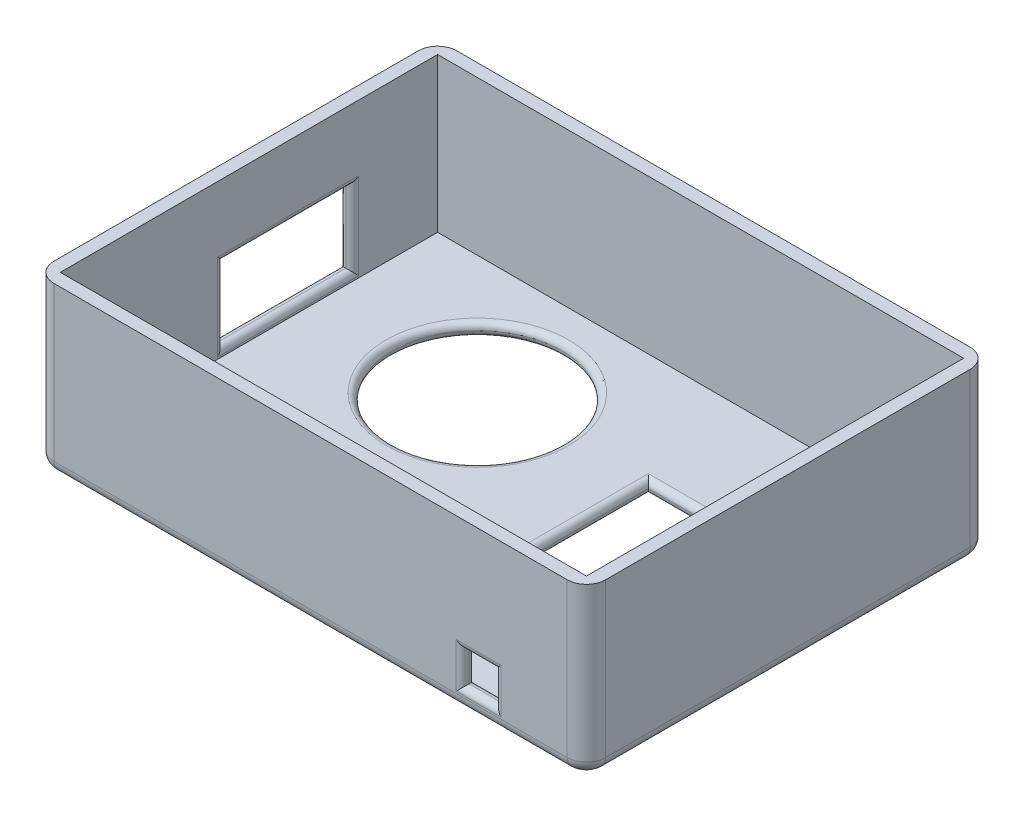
SolidWorks part; units mm, degrees
ref_plane "Front Plane" through (0, 0, 0) normal (0, 0, 1) x (1, 0, 0)
ref_plane "Top Plane" through (0, 0, 0) normal (0, 1, 0) x (1, 0, 0)
ref_plane "Right Plane" through (0, 0, 0) normal (1, 0, 0) x (0, 0, -1)
sketch "Sketch1" plane through (0, 0, 0) normal (0, 1, 0) x (1, 0, 0)
  line L1 (33.232, -29) -> (-48.768, -29)
  line L2 (33.232, -29) -> (33.232, 29.798)
  line L3 (33.232, 29.798) -> (-48.768, 29.798)
  line L4 (-48.768, -29) -> (-48.768, 29.798)
  line L5 (-50.768, -31) -> (35.232, -31)
  line L6 (-50.768, -31) -> (-50.768, 31.798)
  line L7 (-50.768, 31.798) -> (35.232, 31.798)
  line L8 (35.232, -31) -> (35.232, 31.798)
  line L9 (1.232, 12.648) -> (18.732, 12.648)
  line L10 (1.232, 12.648) -> (1.232, -23)
  line L11 (1.232, -23) -> (18.732, -23)
  line L12 (18.732, 12.648) -> (18.732, -23)
  line L13 (-50.768, 31.798) -> (35.232, 31.798)
  line L14 (-50.768, 31.798) -> (-50.768, -31)
  line L15 (-50.768, -31) -> (35.232, -31)
  line L16 (35.232, 31.798) -> (35.232, -31)
  line L17 (-48.768, 29.798) -> (33.232, 29.798)
  line L18 (-48.768, 29.798) -> (-48.768, -29)
  line L19 (-48.768, -29) -> (33.232, -29)
  line L20 (33.232, 29.798) -> (33.232, -29)
  circle A1 centre (-24.017, 11.249) radius 13.249
  point P0 (0, 0)
  point P6 (0, 0)
  point P11 (9.882, 11.072)
  point P18 (9.982, 12.648)
  dimension "D8" = 14.5
  dimension "D1" = 82
  dimension "D2" = 2
  dimension "D3" = 2
  dimension "D4" = 2
  dimension "D5" = 2
  dimension "D6" = 6
  dimension "D7" = 17.5
  dimension "D9" = 17.15
extrude "Boss-Extrude6" add sketch "Sketch1" along normal blind 2 contours L4 L1 L2 L3 A1 L9 L12 L11 L10
sketch "Sketch3" plane through (0, 0, 0) normal (0, 1, 0) x (1, 0, 0)
  line L1 (-50.768, 31.798) -> (35.232, 31.798)
  line L2 (-50.768, 31.798) -> (-50.768, -31)
  line L3 (-50.768, -31) -> (35.232, -31)
  line L4 (35.232, 31.798) -> (35.232, -31)
  line L5 (-48.768, 29.798) -> (33.232, 29.798)
  line L6 (-48.768, 29.798) -> (-48.768, -29)
  line L7 (-48.768, -29) -> (33.232, -29)
  line L8 (33.232, 29.798) -> (33.232, -29)
  dimension "D1" = 2
  dimension "D2" = 2
  dimension "D3" = 2
  dimension "D4" = 2
extrude "Boss-Extrude7" add sketch "Sketch3" along normal blind 26
fillet "Fillet1" radius 3 4 edges at (-50.768, 13, 31) (35.232, 13, 31) (35.232, 13, -31.798) (-50.768, 13, -31.798)
fillet "Fillet2" radius 2 8 edges at (34.3533, 0, 30.1213) (-49.8893, 0, 30.1213) (-49.8893, 0, -30.9193) (34.3533, 0, -30.9193) (-7.768, 0, -31.798) (-50.768, 0, -0.399) (-7.768, 0, 31) (35.232, 0, -0.399)
fillet "Fillet3" radius 1 8 edges at (9.982, 0, -12.648) (9.982, 2, -12.648) (18.732, 2, 5.176) (18.732, 0, 5.176) (9.982, 2, 23) (9.982, 0, 23) (1.232, 2, 5.176) (1.232, 0, 5.176)
fillet "Fillet4" radius 1 2 edges at (-24.017, 2, 2) (-24.017, 0, 2)
sketch "Sketch5" plane through (0, 0, 31) normal (0, 0, 1) x (1, 0, 0)
  line L0 (-47.768, 2) -> (32.232, 2) construction
  line L1 (15.932, 8.3) -> (20.932, 8.3)
  line L2 (15.932, 8.3) -> (15.932, 3.3)
  line L3 (15.932, 3.3) -> (20.932, 3.3)
  line L4 (20.932, 8.3) -> (20.932, 3.3)
  line L5 (32.232, 2) -> (32.232, 26) construction
  dimension "D1" = 1.3
  dimension "D2" = 5
  dimension "D3" = 11.3
  dimension "D4" = 5
extrude "Cut-Extrude1" cut sketch "Sketch5" against normal blind 26
sketch "Sketch7" plane through (-50.768, 0, 0) normal (-1, 0, 0) x (0, 0, 1)
  line L0 (-28.798, 2) -> (28, 2) construction
  line L6 (-16.498, 14.8) -> (3.502, 14.8)
  line L8 (-16.498, 14.8) -> (-16.498, 3.3)
  line L9 (-16.498, 3.3) -> (3.502, 3.3)
  line L10 (3.502, 14.8) -> (3.502, 3.3)
  line L11 (-28.798, 26) -> (-28.798, 2) construction
  dimension "D3" = 11.5
  dimension "D1" = 1.3
  dimension "D2" = 12.3
  dimension "D4" = 20
extrude "Cut-Extrude2" cut sketch "Sketch7" against normal blind 26
fillet "Fillet5" radius 1 8 edges at (-50.768, 9.05, -16.498) (-48.768, 9.05, -16.498) (-50.768, 3.3, -6.498) (-48.768, 3.3, -6.498) (-48.768, 9.05, 3.502) (-50.768, 9.05, 3.502) (-48.768, 14.8, -6.498) (-50.768, 14.8, -6.498)
fillet "Fillet6" radius 1 8 edges at (15.932, 5.8, 31) (15.932, 5.8, 29) (18.432, 3.3, 31) (18.432, 3.3, 29) (20.932, 5.8, 29) (20.932, 5.8, 31) (18.432, 8.3, 29) (18.432, 8.3, 31)
